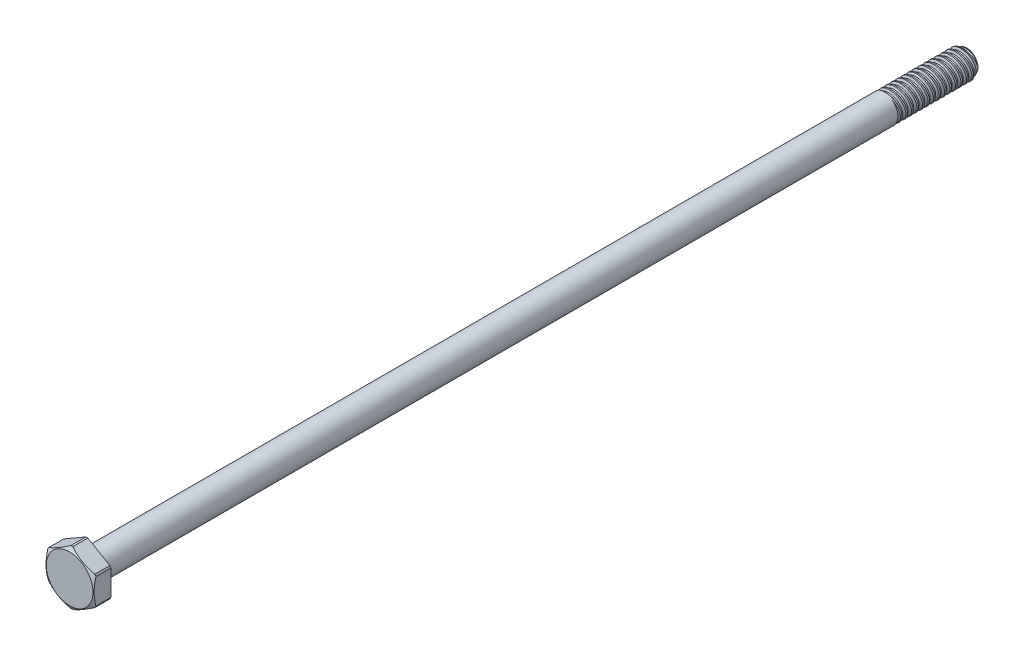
SolidWorks part; units mm, degrees
ref_plane "Front" through (0, 0, 0) normal (0, 0, 1) x (1, 0, 0)
ref_plane "Top" through (0, 0, 0) normal (0, 1, 0) x (1, 0, 0)
ref_plane "Right" through (0, 0, 0) normal (1, 0, 0) x (0, 0, -1)
sketch "Sketch1" plane through (0, 0, 0) normal (1, 0, 0) x (0, 0, -1)
  line L0 (0, 0) -> (-184.15, 0) construction
  line L1 (-184.15, 0) -> (-184.15, 5.5562) construction
  line L2 (-184.15, 0) -> (-188.1188, 0) construction
  line L3 (0, -3.175) -> (19.05, -3.175) construction
  line L4 (0, 0) -> (19.05, 0)
  line L5 (0, 0) -> (0, 3.175)
  line L6 (0, 3.175) -> (19.05, 3.175)
  line L7 (19.05, 0) -> (19.05, 3.175)
revolve "Revolve1" add sketch "Sketch1" angle 360 about L0
sketch "Sketch2" plane through (0, 0, 0) normal (1, 0, 0) x (0, 0, -1)
  line L0 (0, 3.175) -> (0, -3.175) construction
  line L1 (0, -3.175) -> (1.27, -3.175) construction
  line L2 (1.27, -3.175) -> (0, 3.175) construction
  line L3 (0, 3.175) -> (0.1557, 3.2061) construction
  line L4 (1.2453, 3.4241) -> (0.1557, 3.2061)
  line L5 (0.1557, 3.2061) -> (0.6796, 2.6099)
  line L6 (0.6796, 2.6099) -> (0.991, 2.6722)
  line L7 (0.991, 2.6722) -> (1.2453, 3.4241)
  line L8 (0.8353, 2.641) -> (0.7005, 3.3151) construction
  line L9 (0, 0) -> (0, 3.175) construction
  line L10 (0, 3.175) -> (0.7285, 3.175) construction
  line L11 (0.7285, 3.175) -> (1.9985, -3.175) construction
  line L12 (1.9985, -3.175) -> (1.27, -3.175) construction
  line L13 (0, -3.175) -> (19.05, -3.175) construction
  line L14 (0, -0.2727) -> (2.727, 0.2727) construction
  line L15 (0, 3.175) -> (19.05, 3.175) construction
  point P17 (1.3635, 0)
revolve "Cut-Revolve1" cut sketch "Sketch2" angle 360 about L14
sketch "Sketch3" plane through (0, 0, 0) normal (1, 0, 0) x (0, 0, -1)
  line L0 (17.8382, 3.175) -> (19.05, 2.6099)
  line L1 (19.05, 2.6099) -> (19.05, 3.175)
  line L2 (19.05, 3.175) -> (17.8382, 3.175)
  line L3 (0, 3.175) -> (19.05, 3.175) construction
  line L4 (19.05, 0) -> (19.05, 3.175) construction
  line L5 (0.6796, 2.6099) -> (19.05, 2.6099) construction
  line L6 (17.8382, 3.175) -> (17.8382, -3.175) construction
  line L7 (0, -3.175) -> (19.05, -3.175) construction
  line L8 (0, 0) -> (17.8382, 0) construction
  dimension "D1" = 25
  dimension "D2" = 6.35
revolve "Cut-Revolve2" cut sketch "Sketch3" angle 360 about L8
pattern_linear "LPattern1" count 2 spacing 1.27 along (0, 0, 1) count 15 spacing 1.27 along (0, 0, 1)
sketch "Sketch4" plane through (0, 0, 0) normal (1, 0, 0) x (0, 0, -1)
  line L0 (-184.15, 0) -> (-184.15, 5.5562) construction
  line L1 (0, 0) -> (-184.15, 0)
  line L2 (0, 0) -> (0, 3.175)
  line L3 (0, 3.175) -> (-184.15, 3.175)
  line L4 (-184.15, 0) -> (-184.15, 3.175)
  line L5 (0, 3.175) -> (19.05, 3.175) construction
  line L6 (-184.15, 0) -> (-188.1188, 0) construction
revolve "Revolve2" add sketch "Sketch4" angle 360 about L6
sketch "Sketch5" plane through (0, 0, 184.15) normal (0, 0, 1) x (1, 0, 0)
  line L1 (0, 6.4158) -> (-5.5562, 3.2079)
  line L2 (-5.5562, 3.2079) -> (-5.5562, -3.2079)
  line L3 (-5.5562, -3.2079) -> (0, -6.4158)
  line L4 (0, -6.4158) -> (5.5562, -3.2079)
  line L5 (5.5562, -3.2079) -> (5.5562, 3.2079)
  line L6 (5.5562, 3.2079) -> (0, 6.4158)
  circle A0 centre (0, 0) radius 5.5562 construction
  dimension "D1" = 11.1125
extrude "Extrude1" add sketch "Sketch5" along normal up to vertex
sketch "Sketch6" plane through (0, 0, 0) normal (1, 0, 0) x (0, 0, -1)
  line L0 (-188.1188, 5.3896) -> (-187.5996, 6.2888)
  line L1 (-187.5996, 6.2888) -> (-184.15, 6.2888)
  line L2 (-184.15, 6.2888) -> (-184.15, 6.7968)
  line L3 (-184.15, 6.7968) -> (-188.1187, 6.7968)
  line L4 (-188.1187, 6.7968) -> (-188.1188, 5.3896)
  line L5 (-188.1188, 3.2079) -> (-188.1188, 6.4158) construction
  line L6 (-188.1188, 6.4158) -> (-184.15, 6.4158) construction
  line L7 (-184.15, 3.2079) -> (-184.15, 6.4158) construction
  line L8 (0, 0) -> (-187.5996, 0) construction
  line L9 (-184.15, 0) -> (-188.1188, 0) construction
  line L10 (-187.5996, 0) -> (-187.5996, 6.2888) construction
  line L11 (-186.1344, 6.7968) -> (-186.1344, 0) construction
revolve "Cut-Revolve3" cut sketch "Sketch6" angle 360 about L8
fillet "Fillet1" radius 0.635
equation "\"D3@Sketch2\"=\"Thread Pitch@Sketch2\"/4"
equation "\"D4@Sketch2\"=\"Thread Pitch@Sketch2\"/8"
equation "\"D1@Sketch2\"=\"Thread Pitch@Sketch2\""
equation "\"D3@LPattern1\"=\"Thread Pitch@Sketch2\""
equation "\"D4@LPattern1\"=\"Thread Pitch@Sketch2\""
equation "\"D2@LPattern1\"=\"Min Thread Length@Sketch1\"/\"Thread Pitch@Sketch2\""
equation "\"D4@Sketch6\"=\"Head Width@Sketch1\"*.97"
equation "\"D1@Fillet1\"=\"Screw Dia@Sketch1\"/10"
